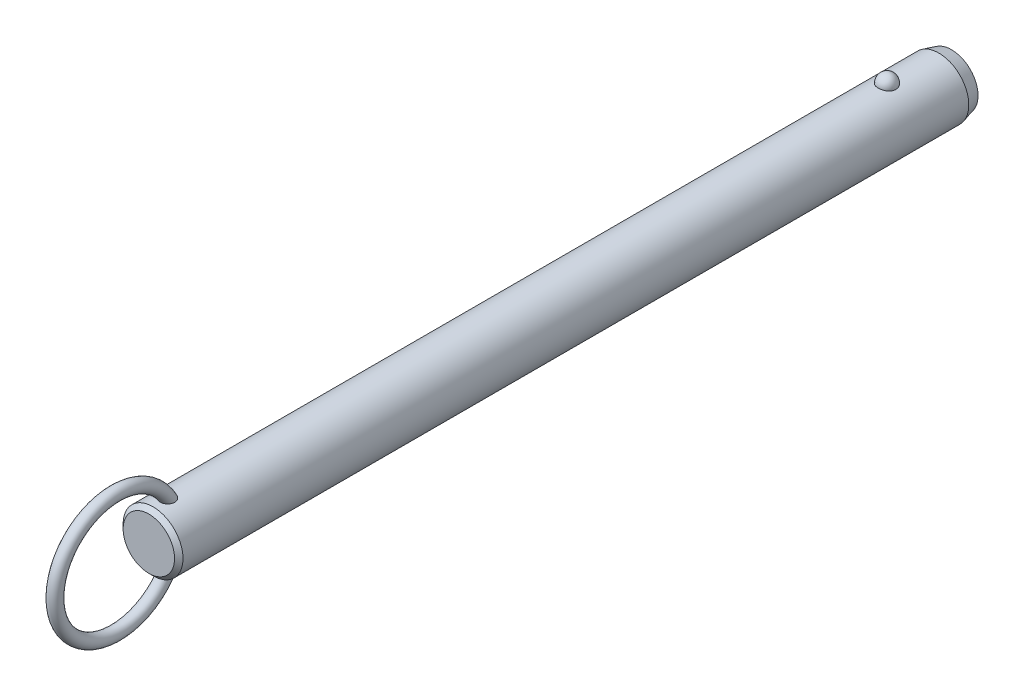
SolidWorks part; units mm, degrees
ref_plane "Front Plane" through (0, 0, 0) normal (0, 0, 1) x (1, 0, 0)
ref_plane "Top Plane" through (0, 0, 0) normal (0, 1, 0) x (1, 0, 0)
ref_plane "Right Plane" through (0, 0, 0) normal (1, 0, 0) x (0, 0, -1)
sketch "Sketch2" plane through (0, 0, 0) normal (0, 0, 1) x (1, 0, 0)
  circle A0 centre (0, 0) radius 7.1
  point P3 (0, 7.1)
  dimension "D1" = 14.2
extrude "Boss-Extrude1" add sketch "Sketch2" along normal blind 165.1
sketch "Sketch3" plane through (0, 0, 0) normal (0, 0, -1) x (-1, 0, 0)
  circle A0 centre (0, 0) radius 7.1
  dimension "D1" = 14.2
extrude "Boss-Extrude2" add sketch "Sketch3" along normal blind 17.4
chamfer "Chamfer1" distance 3 angle 15 1 edges at (-7.1, 0, -17.4)
sketch "Sketch12" plane through (0, 0, 0) normal (1, 0, 0) x (0, 0, -1)
  line L0 (-165.1, 7.1) -> (-165.1, -7.1) construction
  point P0 (-165.1, 0)
sketch "Sketch13" plane through (0, 0, 0) normal (1, 0, 0) x (0, 0, -1)
  circle A0 centre (-180.95, 0) radius 15.85
  point P2 (-165.1, 0)
  dimension "D1" = 31.7
sketch "Sketch14" plane through (0, 0, 0) normal (0, 1, 0) x (1, 0, 0)
  circle A0 centre (0, -166.6) radius 1.5
  point P2 (0, -165.1)
  dimension "D1" = 3
sweep "Sweep1" add profiles "Sketch14" path "Sketch13"
sketch "Sketch15" plane through (0, 0, 165.1) normal (0, 0, 1) x (1, 0, 0)
  circle A0 centre (0, 0) radius 7.1
  dimension "D1" = 14.2
extrude "Boss-Extrude3" add sketch "Sketch15" along normal blind 7.92
chamfer "Chamfer2" distance 1 angle 45 1 edges at (7.1, 0, 173.02)
sketch "Sketch18" plane through (0, 0, 0) normal (1, 0, 0) x (0, 0, -1)
  line L0 (14.4, 7.1) -> (-166.7792, 7.1) construction
  line L1 (2.1, 9.2) -> (2.1, 5)
  line L2 (-166.7792, -7.1) -> (14.4, -7.1) construction
  arc A0 (2.1, 9.2) -> (2.1, 5) centre (2.1, 7.1) ccw
  point P4 (0, 7.1)
  dimension "D1" = 16.3
revolve "Revolve1" add sketch "Sketch18" angle 360 about L1
